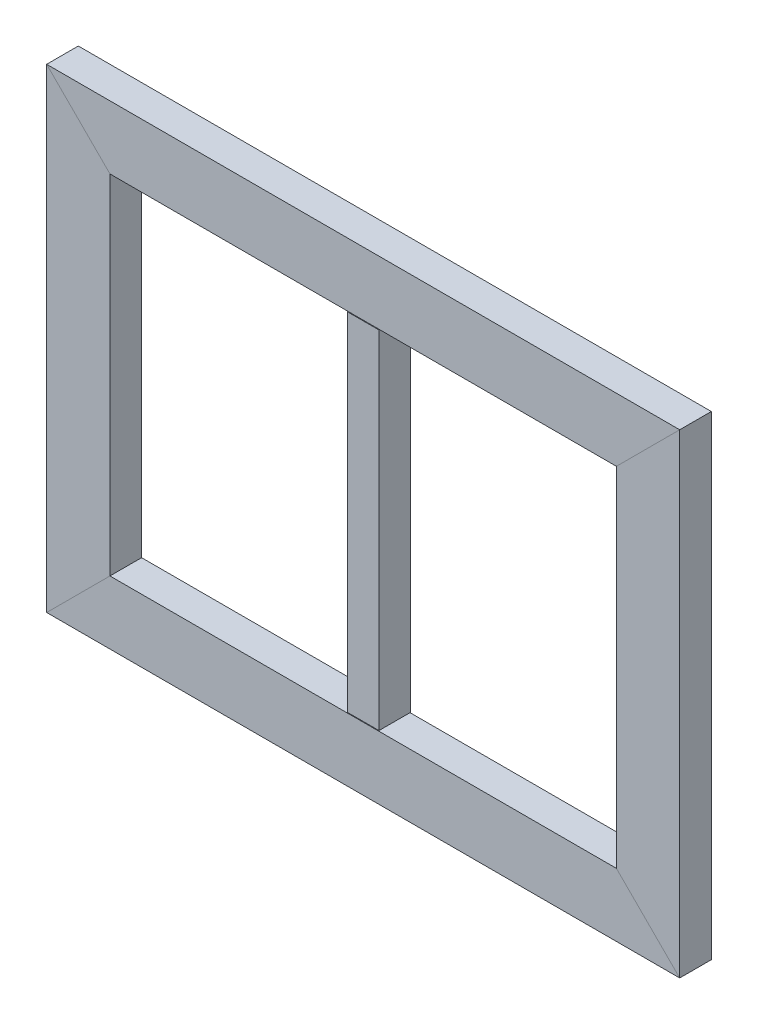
SolidWorks part; units mm, degrees
other "Element opisowy1"
other "Element opisowy2"
other "Element opisowy3"
other "Element opisowy4"
other "Element opisowy5"
other "Element opisowy6"
other "Folder spoin"
other "Ścieg spoiny1"
other "Ścieg spoiny2"
other "Ścieg spoiny3"
other "Ścieg spoiny4"
other "Ścieg spoiny5"
other "Ścieg spoiny6"
ref_plane "Płaszczyzna przednia" through (0, 0, 0) normal (0, 0, 1) x (1, 0, 0)
ref_plane "Płaszczyzna górna" through (0, 0, 0) normal (0, 1, 0) x (1, 0, 0)
ref_plane "Płaszczyzna prawa" through (0, 0, 0) normal (1, 0, 0) x (0, 0, -1)
sketch "Szkic1" plane through (0, 0, 0) normal (0, 0, 1) x (1, 0, 0)
  line L0 (0, 375) -> (0, -375)
  line L1 (500, -375) -> (-500, -375)
  line L2 (500, -375) -> (500, 375)
  line L3 (500, 375) -> (-500, 375)
  line L4 (-500, -375) -> (-500, 375)
  line L5 (500, -375) -> (-500, 375) construction
  line L6 (500, 375) -> (-500, -375) construction
  point P0 (0, 0)
  dimension "D1" = 750
  dimension "D2" = 1000
other "Rury prostokątne 100 X 50 X 5(1)"
ref_plane "Płaszczyzna1" through (-500, -375, 0) normal (0, 1, 0) x (-1, 0, 0)
sketch "Szkic11" plane through (-500, -375, 0) normal (0, 1, 0) x (-1, 0, 0)
  line L0 (-45, -20) -> (-45, 20)
  line L1 (50, -25) -> (-50, -25)
  line L2 (50, -25) -> (50, 25)
  line L3 (50, 25) -> (-50, 25)
  line L4 (-50, -25) -> (-50, 25)
  line L5 (50, -25) -> (-50, 25) construction
  line L6 (50, 25) -> (-50, -25) construction
  line L7 (45, 20) -> (-45, 20)
  line L8 (45, -20) -> (45, 20)
  line L9 (45, -20) -> (-45, -20)
  point P0 (0, 0)
  point P6 (-50, 0)
  point P7 (0, 25)
  point P12 (50, 0)
  point P13 (0, -25)
  point P14 (0, 0)
  dimension "D2" = 50
  dimension "D3" = 100
  dimension "D1" = 5
other "Rury kwadratowe 50 X 50 X 3(1)"
ref_plane "Płaszczyzna2" through (0, 375, 0) normal (0, -1, 0) x (1, 0, 0)
sketch "Szkic12" plane through (0, 375, 0) normal (0, -1, 0) x (1, 0, 0)
  line L0 (-22, -22) -> (-22, 22)
  line L1 (25, -25) -> (-25, -25)
  line L2 (25, -25) -> (25, 25)
  line L3 (25, 25) -> (-25, 25)
  line L4 (-25, -25) -> (-25, 25)
  line L5 (25, -25) -> (-25, 25) construction
  line L6 (25, 25) -> (-25, -25) construction
  line L7 (22, 22) -> (-22, 22)
  line L8 (22, -22) -> (22, 22)
  line L9 (22, -22) -> (-22, -22)
  point P0 (0, 0)
  point P6 (-25, 0)
  point P7 (0, 25)
  point P12 (25, 0)
  point P13 (0, -25)
  point P14 (0, 0)
  dimension "D2" = 50
  dimension "D3" = 50
  dimension "D1" = 3
other "Przytnij/Wydłuż1"
